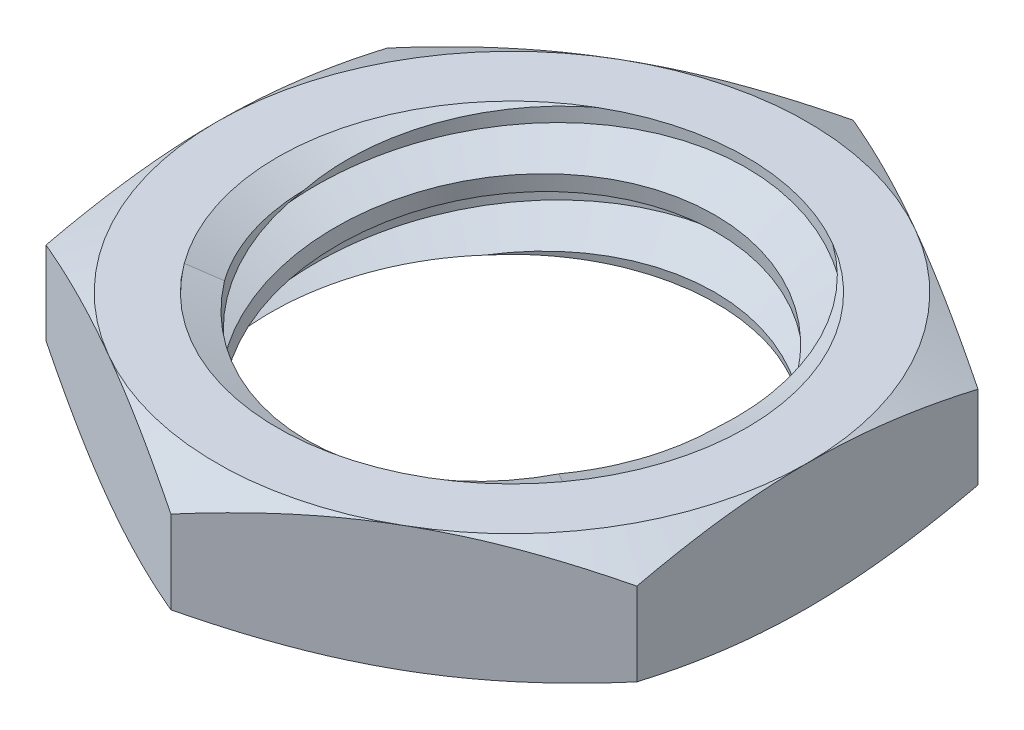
SolidWorks part; units mm, degrees
ref_plane "Front" through (0, 0, 0) normal (0, 0, 1) x (1, 0, 0)
ref_plane "Top" through (0, 0, 0) normal (0, 1, 0) x (1, 0, 0)
ref_plane "Right" through (0, 0, 0) normal (1, 0, 0) x (0, 0, -1)
sketch "Sketch1" plane through (0, 0, 0) normal (0, 1, 0) x (1, 0, 0)
  line L1 (0, 4.6188) -> (-4, 2.3094)
  line L2 (-4, 2.3094) -> (-4, -2.3094)
  line L3 (-4, -2.3094) -> (0, -4.6188)
  line L4 (0, -4.6188) -> (4, -2.3094)
  line L5 (4, -2.3094) -> (4, 2.3094)
  line L6 (4, 2.3094) -> (0, 4.6188)
  circle A0 centre (0, 0) radius 4 construction
  dimension "Hex Flats" = 8
extrude "Extrude1" add sketch "Sketch1" along normal blind 1.7
sketch "Sketch2" plane through (0, 0, 0) normal (1, 0, 0) x (0, 0, -1)
  line L0 (-3.175, 0) -> (-3.175, 1.7) construction
  line L1 (0, 0) -> (3.175, 0)
  line L2 (0, 0) -> (0, 1.7)
  line L3 (0, 1.7) -> (3.175, 1.7)
  line L4 (3.175, 0) -> (3.175, 1.7)
  line L5 (-2.3094, 1.7) -> (2.3094, 1.7) construction
  line L7 (0, -3.175) -> (0, 0) construction
  dimension "Thread Dia" = 6.35
revolve "Revolve1" add sketch "Sketch2" angle 360 about L7
sketch "Sketch3" plane through (0, 0, 0) normal (1, 0, 0) x (0, 0, -1)
  line L0 (3.175, 1.7) -> (-3.175, 1.7) construction
  line L1 (-3.175, 1.7) -> (-3.175, 0.7929) construction
  line L2 (-3.175, 0.7929) -> (3.175, 1.7) construction
  line L3 (3.175, 1.7) -> (3.191, 1.5877) construction
  line L4 (3.191, 1.5877) -> (3.3033, 0.802)
  line L5 (3.3033, 0.802) -> (2.7771, 1.0132)
  line L6 (2.7771, 1.0132) -> (2.7451, 1.2377)
  line L7 (2.7451, 1.2377) -> (3.191, 1.5877)
  line L8 (2.7611, 1.1254) -> (3.2472, 1.1949) construction
  line L9 (3.175, 1.7) -> (3.175, 1.1846) construction
  line L10 (3.175, 1.1846) -> (-3.175, 0.2774) construction
  line L11 (-3.175, 0.2774) -> (-3.175, 0.7929) construction
  line L12 (-0.1384, 1.7) -> (0.1384, -0.238) construction
  line L13 (-3.175, 0) -> (-3.175, 1.7) construction
  line L14 (0, 1.7) -> (3.175, 1.7) construction
  line L15 (3.175, 0) -> (3.175, 1.7) construction
  point P13 (0, 0.731)
revolve "Cut-Revolve1" cut sketch "Sketch3" angle 360 about L12
pattern_linear "LPattern1" count 2 spacing 0.9071 along (0, -1, 0) count 2 spacing 0.9071 along (0, 1, 0) of "Cut-Revolve1"
sketch "Sketch4" plane through (0, 0, 0) normal (1, 0, 0) x (0, 0, -1)
  line L0 (0, 1.7) -> (3.175, 1.7)
  line L1 (3.175, 1.7) -> (2.7451, 1.4995)
  line L2 (2.7451, 1.4995) -> (2.7451, 0.2005)
  line L3 (2.7451, 0.2005) -> (3.175, 0)
  line L4 (3.175, 0) -> (0, 0)
  line L5 (0, 0) -> (0, 1.7)
  line L6 (3.175, 0) -> (3.175, 1.7) construction
  line L7 (0, 1.7) -> (3.175, 1.7) construction
  line L8 (0, 0) -> (3.175, 0) construction
  line L9 (0, 0) -> (0, 1.7) construction
  line L10 (0, 1.7) -> (0, 2.1744) construction
  dimension "D1" = 25
revolve "Cut-Revolve2" cut sketch "Sketch4" angle 360 about L10
combine bodies "Combine1" operation type subtract main body 112 bodies to subtract 111
sketch "Sketch5" plane through (0, 0, 0) normal (1, 0, 0) x (0, 0, -1)
  line L0 (0, 0) -> (4, 0)
  line L1 (4, 0) -> (4.6188, 0.2886)
  line L2 (4.6188, 0.2886) -> (4.6188, 1.4114)
  line L3 (4.6188, 1.4114) -> (4, 1.7)
  line L4 (0, 1.7) -> (0, 2.97)
  line L5 (0, 2.97) -> (5.8888, 2.97)
  line L6 (5.8888, 2.97) -> (5.8888, -1.27)
  line L7 (5.8888, -1.27) -> (0, -1.27)
  line L8 (0, -1.27) -> (0, 0)
  line L9 (4, 1.7) -> (4, 0) construction
  line L10 (0, 0) -> (3.175, 0) construction
  line L12 (4, 1.7) -> (0, 1.7)
  line L13 (4.6188, 0.85) -> (5.8888, 0.85) construction
  line L14 (4.6188, 1.7) -> (4.6188, 0) construction
  line L15 (0, 0) -> (0, 1.7) construction
  line L22 (0, 1.7) -> (3.175, 1.7) construction
  dimension "D1" = 25
  dimension "D2" = 1.27
  dimension "D3" = 1.7
revolve "Cut-Revolve3" cut sketch "Sketch5" angle 360 about L15
equation "\"D1@Sketch3\"=\"Thread Pitch@Sketch3\"/8"
equation "\"D2@Sketch3\"=\"Thread Pitch@Sketch3\"/4"
equation "\"D5@Sketch3\"=\"Thread Pitch@Sketch3\""
equation "\"D4@LPattern1\"=\"Thread Pitch@Sketch3\""
equation "\"D3@LPattern1\"=\"Thread Pitch@Sketch3\""
equation "\"D1@LPattern1\"=\"Height@Extrude1\"/\"Thread Pitch@Sketch3\""
